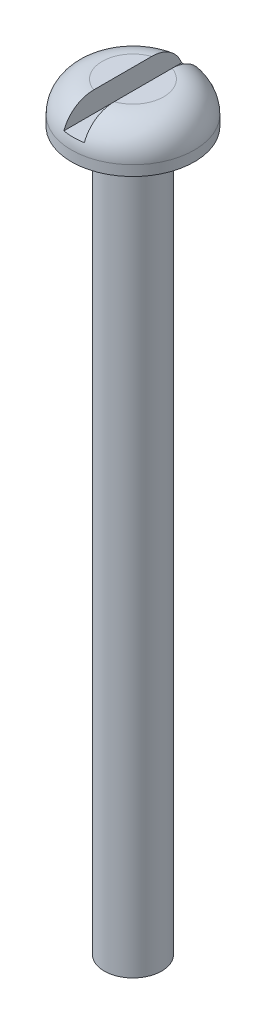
SolidWorks part; units mm, degrees
ref_plane "Plan de face" through (0, 0, 0) normal (0, 0, 1) x (1, 0, 0)
ref_plane "Plan de dessus" through (0, 0, 0) normal (0, 1, 0) x (1, 0, 0)
ref_plane "Plan de droite" through (0, 0, 0) normal (1, 0, 0) x (0, 0, -1)
ref_plane "Plan3" through (0, 6.4, 0) normal (0, 1, 0) x (-1, 0, 0)
sketch "Esquisse1" plane through (0, 6.4, 0) normal (0, 1, 0) x (-1, 0, 0)
  circle A0 centre (0, 0) radius 2.8
extrude "Extrusion1" add sketch "Esquisse1" against normal blind 70
sketch "Esquisse2" plane through (0, 0, 0) normal (0, 0, 1) x (1, 0, 0)
  line L0 (-8, 6.4) -> (8, 6.4) construction
  line L1 (0, 12) -> (0, 4.7448) construction
  line L2 (-8, 10.4) -> (8, 10.4) construction
  line L3 (-6, 11) -> (-6, 5.3938) construction
  line L4 (6, 11.3051) -> (6, 5.5838) construction
  line L6 (-3, 10.4) -> (0, 10.4)
  line L7 (-6, 7.4) -> (-6, 6.4)
  line L8 (-6, 6.4) -> (0, 6.4)
  line L9 (0, 10.4) -> (0, 6.4)
  arc A0 (-3, 10.4) -> (-6, 7.4) centre (-3, 7.4) ccw
  point P17 (-6, 10.4)
  point P21 (0, 6.4)
  dimension "D1" = 3
revolve "Révolution1" add sketch "Esquisse2" angle 360 about L1
sketch "Esquisse3" plane through (0, 0, 0) normal (0, 0, 1) x (1, 0, 0)
  line L0 (0, 9.9885) -> (0, 5.1977) construction
  line L2 (-3.6691, 0) -> (6.2564, 0) construction
  line L3 (-1, 11.0476) -> (-1, 5.7428) construction
  line L4 (1, 11) -> (1, 5.7428) construction
  line L5 (-1, 8.3952) -> (1, 8.3952)
  line L6 (-2.5295, 8.4) -> (1.4809, 8.4) construction
  line L7 (-1, 8.3952) -> (-1, 10.7503)
  line L8 (-1, 10.7503) -> (1, 10.7503)
  line L9 (1, 8.3952) -> (1, 10.7503)
  point P19 (0, 7.5787)
extrude "Enlèv. mat.-Extru.1" cut sketch "Esquisse3" against normal mid plane 13
